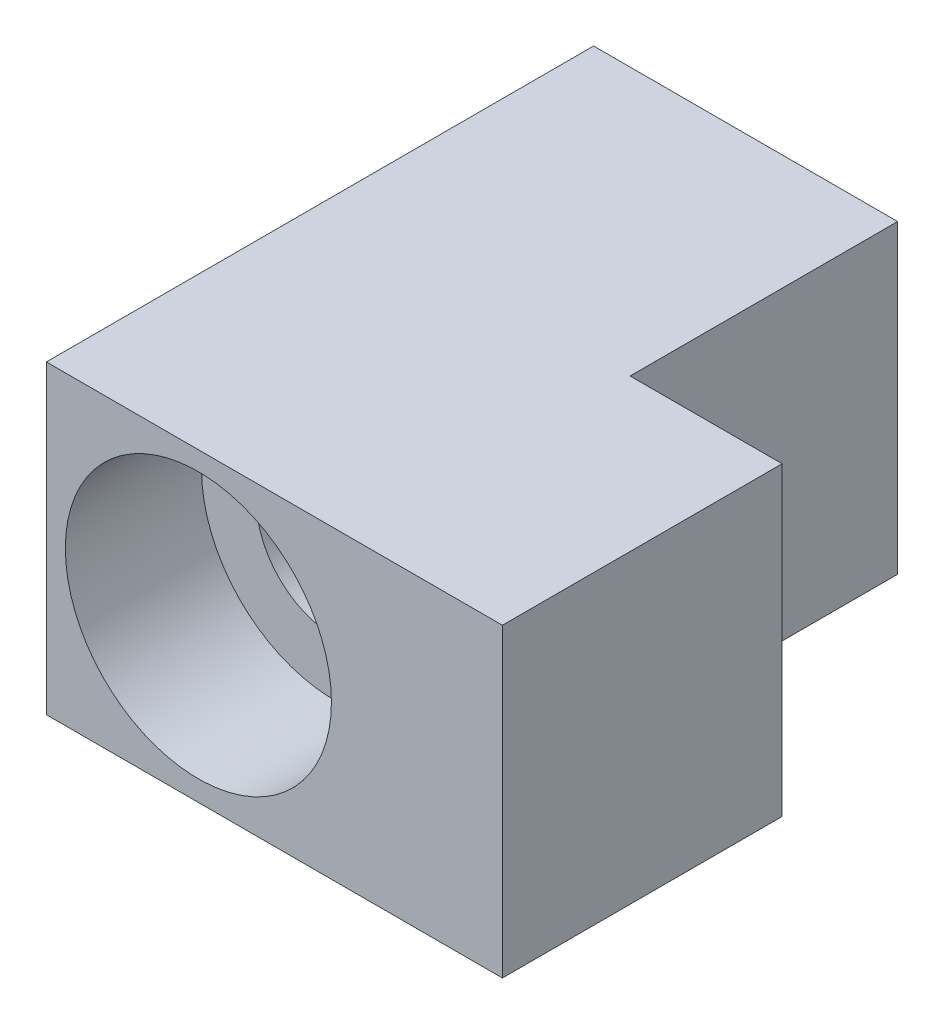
SolidWorks part; units mm, degrees
ref_plane "Front Plane" through (0, 0, 0) normal (0, 0, 1) x (1, 0, 0)
ref_plane "Top Plane" through (0, 0, 0) normal (0, 1, 0) x (1, 0, 0)
ref_plane "Right Plane" through (0, 0, 0) normal (1, 0, 0) x (0, 0, -1)
sketch "Sketch1" plane through (0, 0, 0) normal (0, 0, 1) x (1, 0, 0)
  line L1 (0, 0) -> (6.35, 0)
  line L2 (0, 0) -> (0, 6.3811)
  line L3 (0, 6.3811) -> (6.35, 6.3811)
  line L4 (6.35, 0) -> (6.35, 6.3811)
  dimension "D1" = 6.35
  dimension "D2" = 6.3811
extrude "Boss-Extrude1" add sketch "Sketch1" along normal blind 11.43
sketch "Sketch2" plane through (6.35, 0, 0) normal (1, 0, 0) x (0, 0, -1)
  line L0 (-11.43, 0) -> (0, 0) construction
  line L1 (-11.43, 6.3811) -> (-5.588, 6.3811)
  line L2 (-11.43, 6.3811) -> (-11.43, 0)
  line L3 (-11.43, 0) -> (-5.588, 0)
  line L4 (-5.588, 6.3811) -> (-5.588, 0)
  dimension "D1" = 5.842
extrude "Boss-Extrude2" add sketch "Sketch2" along normal blind 3.175
sketch "Sketch3" plane through (0, 0, 11.43) normal (0, 0, 1) x (1, 0, 0)
  line L0 (0, 6.3811) -> (0, 0) construction
  line L1 (9.525, 6.3811) -> (0, 6.3811) construction
  circle A0 centre (3.175, 3.2061) radius 1.2014
  dimension "D1" = 3.175
  dimension "D2" = 3.175
hole_wizard "CBORE for #4 Socket Head Cap Screw1" positions "Sketch7" profile "Sketch6" counterbore size "#4" standard "ANSI Inch"
sketch "Sketch7" plane through (0, 0, 11.43) normal (0, 0, 1) x (1, 0, 0)
  point P0 (3.175, 3.2061)
sketch "Sketch6" plane through (3.175, 3.2061, 11.43) normal (1, 0, 0) x (0, -1, 0)
  line L0 (0, 0) -> (0, 11.43)
  line L1 (0, 11.43) -> (1.6319, 11.43)
  line L3 (1.6319, 11.43) -> (1.632, 2.8448)
  line L4 (1.632, 2.8448) -> (2.7788, 2.8448)
  line L5 (2.7788, 2.8448) -> (2.7788, 0)
  line L7 (2.7788, 0) -> (0, 0)
  line L11 (0, -6.35) -> (0, 107.95) construction
  dimension "Thru Hole Dia." = 3.2639
  dimension "Thru Hole Depth" = 11.43
  dimension "C'Bore Dia." = 5.5575
  dimension "C'Bore Depth" = 2.8448
